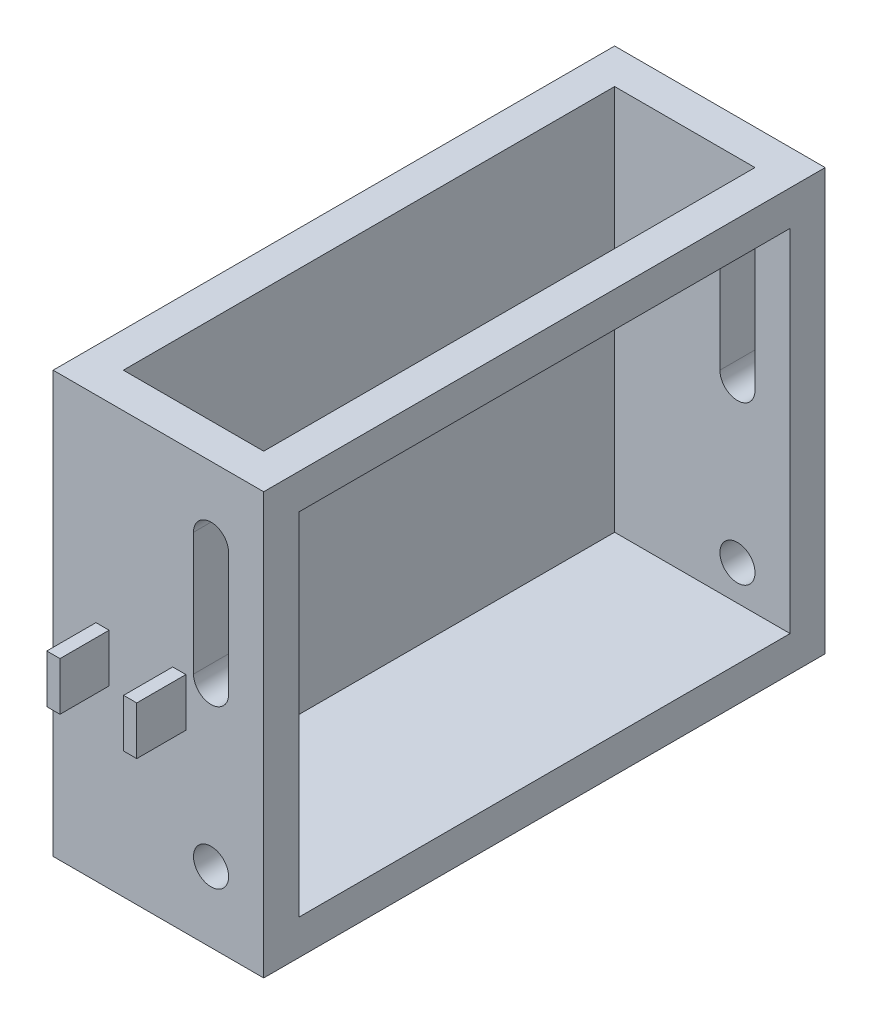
SolidWorks part; units mm, degrees
ref_plane "Front Plane" through (0, 0, 0) normal (0, 0, 1) x (1, 0, 0)
ref_plane "Top Plane" through (0, 0, 0) normal (0, 1, 0) x (1, 0, 0)
ref_plane "Right Plane" through (0, 0, 0) normal (1, 0, 0) x (0, 0, -1)
sketch "Sketch1" plane through (0, 0, 0) normal (0, 1, 0) x (1, 0, 0)
  line L1 (0, 0) -> (76.2, 0)
  line L2 (0, 0) -> (0, 203.2)
  line L3 (0, 203.2) -> (76.2, 203.2)
  line L4 (76.2, 0) -> (76.2, 203.2)
  dimension "D1" = 203.2
  dimension "D2" = 76.2
extrude "Boss-Extrude1" add sketch "Sketch1" along normal blind 12.7
sketch "Sketch2" plane through (0, 12.7, 0) normal (0, 1, 0) x (1, 0, 0)
  line L0 (76.2, 0) -> (76.2, 203.2) construction
  line L1 (0, 203.2) -> (76.2, 203.2)
  line L2 (0, 203.2) -> (0, 190.5)
  line L3 (0, 190.5) -> (76.2, 190.5)
  line L4 (76.2, 203.2) -> (76.2, 190.5)
  line L6 (0, 0) -> (76.2, 0)
  line L7 (0, 0) -> (0, 12.7)
  line L8 (0, 12.7) -> (76.2, 12.7)
  line L9 (76.2, 0) -> (76.2, 12.7)
  dimension "D1" = 12.7
  dimension "D2" = 12.7
extrude "Boss-Extrude2" add sketch "Sketch2" along normal blind 127
sketch "Sketch3" plane through (0, 139.7, 0) normal (0, 1, 0) x (1, 0, 0)
  line L0 (0, 203.2) -> (0, 0)
  line L1 (0, 0) -> (76.2, 0)
  line L2 (76.2, 0) -> (76.2, 203.2)
  line L3 (76.2, 203.2) -> (0, 203.2)
  line L4 (0, 190.5) -> (76.2, 190.5) construction
  line L5 (12.7, 190.5) -> (63.5, 190.5)
  line L6 (12.7, 190.5) -> (12.7, 12.7)
  line L7 (12.7, 12.7) -> (63.5, 12.7)
  line L8 (63.5, 190.5) -> (63.5, 12.7)
  line L9 (76.2, 12.7) -> (0, 12.7) construction
  dimension "D1" = 12.7
  dimension "D2" = 12.7
extrude "Boss-Extrude3" add sketch "Sketch3" along normal blind 12.7
sketch "Sketch4" plane through (0, 0, 0) normal (0, 0, 1) x (1, 0, 0)
  line L0 (0, 0) -> (76.2, 0) construction
  line L1 (76.2, 152.4) -> (76.2, 0) construction
  line L2 (50.8, 127) -> (50.8, 82.55)
  line L3 (63.5, 127) -> (63.5, 82.55)
  arc A0 (63.5, 127) -> (50.8, 127) centre (57.15, 127) ccw
  arc A1 (50.8, 82.55) -> (63.5, 82.55) centre (57.15, 82.55) ccw
  circle A2 centre (57.15, 25.4) radius 6.35
  point P12 (76.2, 76.2)
  dimension "D5" = 12.7
  dimension "D1" = 25.4
  dimension "D2" = 25.4
  dimension "D3" = 6.35
  dimension "D4" = 19.05
extrude "Cut-Extrude1" cut sketch "Sketch4" against normal through all
sketch "Sketch6" plane through (0, 0, 0) normal (0, 0, 1) x (1, 0, 0)
  line L0 (38.1, 152.4) -> (38.1, 0) construction
  line L1 (0, 152.4) -> (76.2, 152.4) construction
  line L2 (0, 0) -> (76.2, 0) construction
  line L3 (0, 152.4) -> (0, 0) construction
  line L12 (76.2, 76.2) -> (0, 76.2) construction
  line L13 (76.2, 152.4) -> (76.2, 0) construction
  line L15 (15.494, 81.026) -> (20.2565, 81.026)
  line L16 (15.494, 81.026) -> (15.494, 63.5635)
  line L17 (15.494, 63.5635) -> (20.2565, 63.5635)
  line L18 (20.2565, 81.026) -> (20.2565, 63.5635)
  line L19 (43.2753, 81.026) -> (48.0378, 81.026)
  line L20 (43.2753, 81.026) -> (43.2753, 63.5635)
  line L21 (43.2753, 63.5635) -> (48.0378, 63.5635)
  line L22 (48.0378, 81.026) -> (48.0378, 63.5635)
  dimension "D1" = 81.026
  dimension "D2" = 15.494
  dimension "D3" = 23.0188
  dimension "D4" = 4.7625
  dimension "D5" = 17.4625
extrude "Boss-Extrude4" add sketch "Sketch6" along normal blind 17.78
ref_plane "Plane1" through (0, 0, -101.6) normal (0, 0, 1) x (1, 0, 0)
mirror "Mirror1" about plane through (0, 0, -101.6) normal (0, 0, 1) of "Boss-Extrude4"
sketch "Sketch7" plane through (0, 0, 0) normal (-1, 0, 0) x (0, 0, 1)
  line L1 (-203.2, 152.4) -> (0, 152.4)
  line L2 (-203.2, 152.4) -> (-203.2, 0)
  line L3 (-203.2, 0) -> (0, 0)
  line L4 (0, 152.4) -> (0, 0)
extrude "Boss-Extrude5" add sketch "Sketch7" against normal blind 12.7
